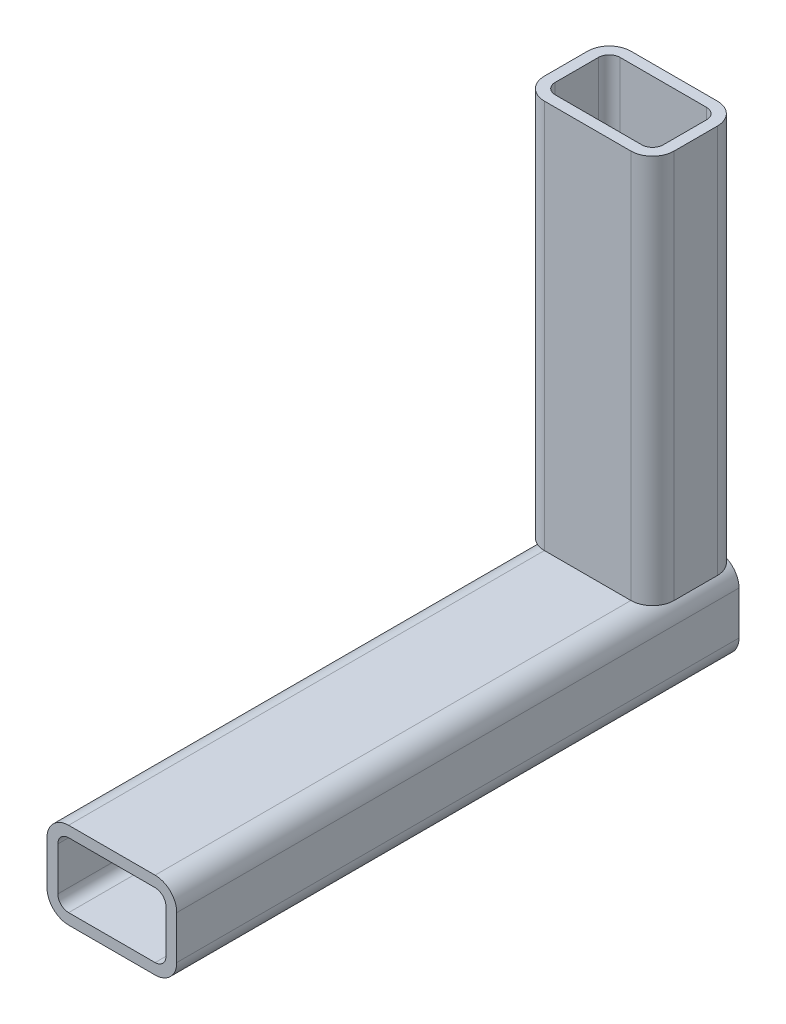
SolidWorks part; units mm, degrees
ref_plane "Front Plane" through (0, 0, 0) normal (0, 0, 1) x (1, 0, 0)
ref_plane "Top Plane" through (0, 0, 0) normal (0, 1, 0) x (1, 0, 0)
ref_plane "Right Plane" through (0, 0, 0) normal (1, 0, 0) x (0, 0, -1)
sketch "Sketch1" plane through (0, 0, 0) normal (1, 0, 0) x (0, 0, -1)
  line L0 (0, 0) -> (0, 254)
  line L1 (0, 0) -> (-304.8, 0)
  dimension "D1" = 304.8
  dimension "D2" = 254
other "Structural Member1"
ref_plane "Plane1" through (0, 0, 0) normal (0, 1, 0) x (-1, 0, 0)
sketch "Sketch12" plane through (0, 0, 0) normal (0, 1, 0) x (0, 0, -1)
  line L0 (-12.7, -31.75) -> (12.7, -31.75)
  line L1 (-19.05, -25.4) -> (-19.05, 25.4)
  line L2 (12.7, 31.75) -> (-12.7, 31.75)
  line L3 (19.05, 25.4) -> (19.05, -25.4)
  line L4 (-12.7, -38.1) -> (12.7, -38.1)
  line L5 (-25.4, -25.4) -> (-25.4, 25.4)
  line L6 (12.7, 38.1) -> (-12.7, 38.1)
  line L7 (25.4, 25.4) -> (25.4, -25.4)
  line L8 (0, 0) -> (25.4, 0) construction
  line L9 (0, 0) -> (0, 38.1) construction
  arc A0 (25.4, 25.4) -> (12.7, 38.1) centre (12.7, 25.4) ccw
  arc A1 (12.7, -38.1) -> (25.4, -25.4) centre (12.7, -25.4) ccw
  arc A2 (-25.4, -25.4) -> (-12.7, -38.1) centre (-12.7, -25.4) ccw
  arc A3 (-12.7, 38.1) -> (-25.4, 25.4) centre (-12.7, 25.4) ccw
  arc A4 (-12.7, 31.75) -> (-19.05, 25.4) centre (-12.7, 25.4) ccw
  arc A5 (19.05, 25.4) -> (12.7, 31.75) centre (12.7, 25.4) ccw
  arc A6 (12.7, -31.75) -> (19.05, -25.4) centre (12.7, -25.4) ccw
  arc A7 (-19.05, -25.4) -> (-12.7, -31.75) centre (-12.7, -25.4) ccw
  point P3 (0, -38.1)
  point P4 (-25.4, 0)
  point P5 (0, 0)
  point P6 (25.4, -38.1)
  point P7 (-25.4, -38.1)
  point P8 (-25.4, 38.1)
  point P33 (0, 0)
  point P35 (25.4, 38.1)
  point P36 (25.4, 0)
  point P37 (0, 38.1)
  dimension "D1" = 12.7
  dimension "Thickness" = 6.35
  dimension "V_leg" = 76.2
  dimension "H_leg" = 50.8
